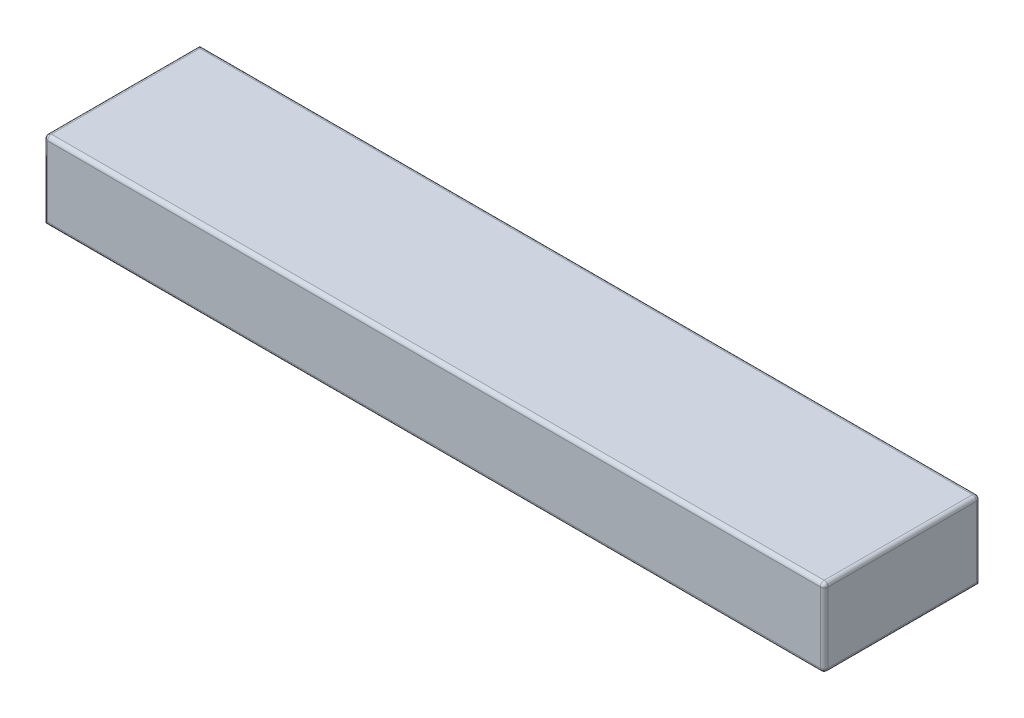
SolidWorks part; units mm, degrees
ref_plane "Front Plane" through (0, 0, 0) normal (0, 0, 1) x (1, 0, 0)
ref_plane "Top Plane" through (0, 0, 0) normal (0, 1, 0) x (1, 0, 0)
ref_plane "Right Plane" through (0, 0, 0) normal (1, 0, 0) x (0, 0, -1)
sketch "Sketch1" plane through (0, 0, 0) normal (0, 1, 0) x (1, 0, 0)
  line L2 (0, 0) -> (100, 0)
  line L3 (0, 0) -> (0, -20)
  line L4 (0, -20) -> (100, -20)
  line L5 (100, 0) -> (100, -20)
  dimension "D1" = 100
  dimension "D2" = 20
extrude "Boss-Extrude1" add sketch "Sketch1" along normal blind 10
fillet "Fillet1" radius 0.5 9 edges at (50, 0, 20) (100, 0, 10) (0, 10, 10) (50, 10, 20) (100, 10, 10) (50, 10, 0) (100, 5, 0) (100, 5, 20) (0, 5, 20)
